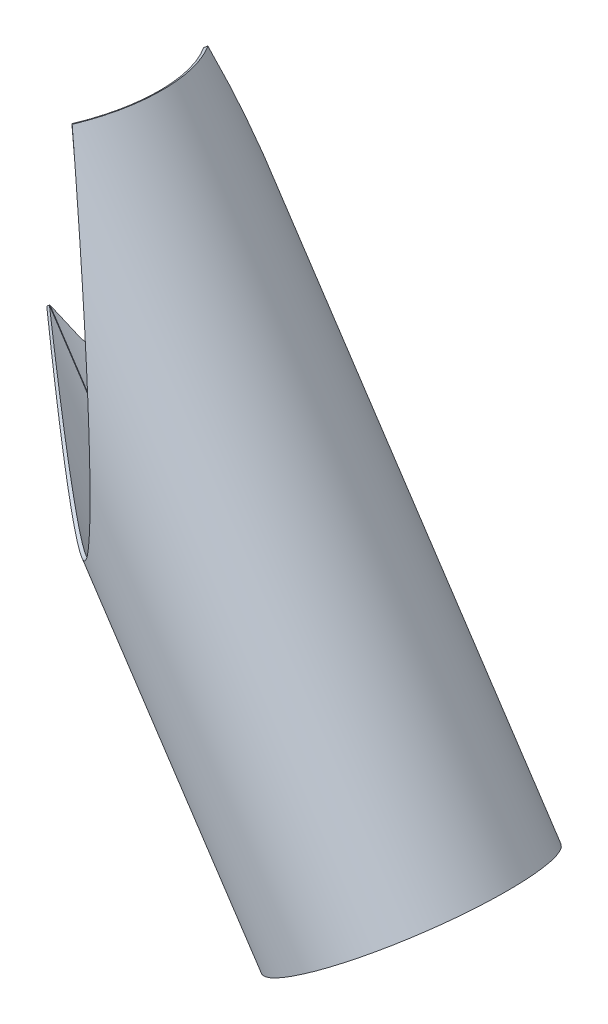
SolidWorks part; units mm, degrees
ref_plane "前视基准面" through (0, 0, 0) normal (0, 0, 1) x (1, 0, 0)
ref_plane "上视基准面" through (0, 0, 0) normal (0, 1, 0) x (1, 0, 0)
ref_plane "右视基准面" through (0, 0, 0) normal (1, 0, 0) x (0, 0, -1)
imported_body "基体零件-等径Y形五通管-1"
sheet metal parameters "钣金1" parameters "D1"=0.7366, "厚度"=6
bend "圆角折弯1" bend radius 204 bend angle 359.727 parameters "D5"=1
flatten bends "展开-折弯1"
sketch "尖角-草图1" plane through (244.5068, -748.5111, 0.5) normal (-0.8333, -0.5528, 0.0024) x (0.002, 0.0013, 1)
  line L0 (640.3992, 441.0845) -> (640.3992, -441.0845) construction
  dimension "D1" = 0
process bends "加工-折弯1" parameters "D1"=0
sketch "平面-草图1" plane through (244.5068, -748.5111, 0.5) normal (-0.8333, -0.5528, 0.0024) x (0.002, 0.0013, 1)
